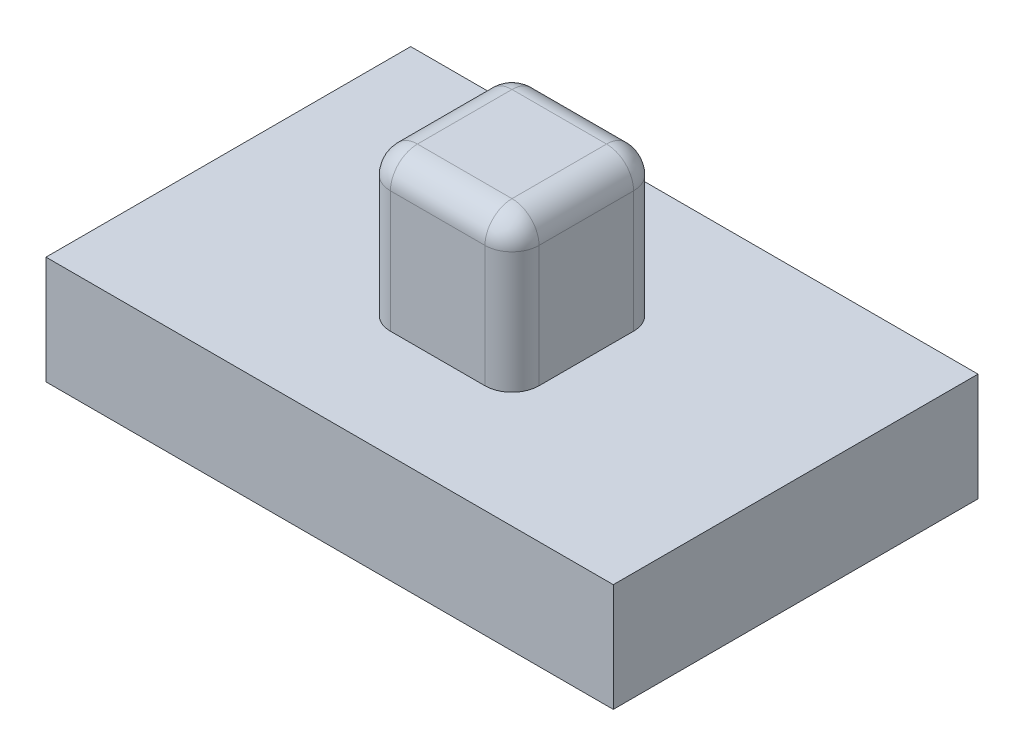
SolidWorks part; units mm, degrees
ref_plane "Front Plane" through (0, 0, 0) normal (0, 0, 1) x (1, 0, 0)
ref_plane "Top Plane" through (0, 0, 0) normal (0, 1, 0) x (1, 0, 0)
ref_plane "Right Plane" through (0, 0, 0) normal (1, 0, 0) x (0, 0, -1)
sketch "Sketch1" plane through (0, 0, 0) normal (0, 1, 0) x (1, 0, 0)
  line L1 (-21, -13.5) -> (21, -13.5)
  line L2 (-21, -13.5) -> (-21, 13.5)
  line L3 (-21, 13.5) -> (21, 13.5)
  line L4 (21, -13.5) -> (21, 13.5)
  line L5 (-21, -13.5) -> (21, 13.5) construction
  line L6 (-21, 13.5) -> (21, -13.5) construction
  point P0 (0, 0)
  dimension "D1" = 42
  dimension "D2" = 27
extrude "Boss-Extrude1" add sketch "Sketch1" along normal blind 8
sketch "Sketch2" plane through (0, 8, 0) normal (0, 1, 0) x (1, 0, 0)
  line L1 (-5.5, -5.5) -> (5.5, -5.5)
  line L2 (-5.5, -5.5) -> (-5.5, 5.5)
  line L3 (-5.5, 5.5) -> (5.5, 5.5)
  line L4 (5.5, -5.5) -> (5.5, 5.5)
  line L5 (-5.5, -5.5) -> (5.5, 5.5) construction
  line L6 (-5.5, 5.5) -> (5.5, -5.5) construction
  point P0 (0, 0)
  dimension "D1" = 11
  dimension "D2" = 11
extrude "Boss-Extrude2" add sketch "Sketch2" along normal blind 11
fillet "Fillet1" radius 2 8 edges at (0, 19, 5.5) (-5.5, 19, 0) (0, 19, -5.5) (5.5, 19, 0) (5.5, 13.5, -5.5) (-5.5, 13.5, -5.5) (-5.5, 13.5, 5.5) (5.5, 13.5, 5.5)
